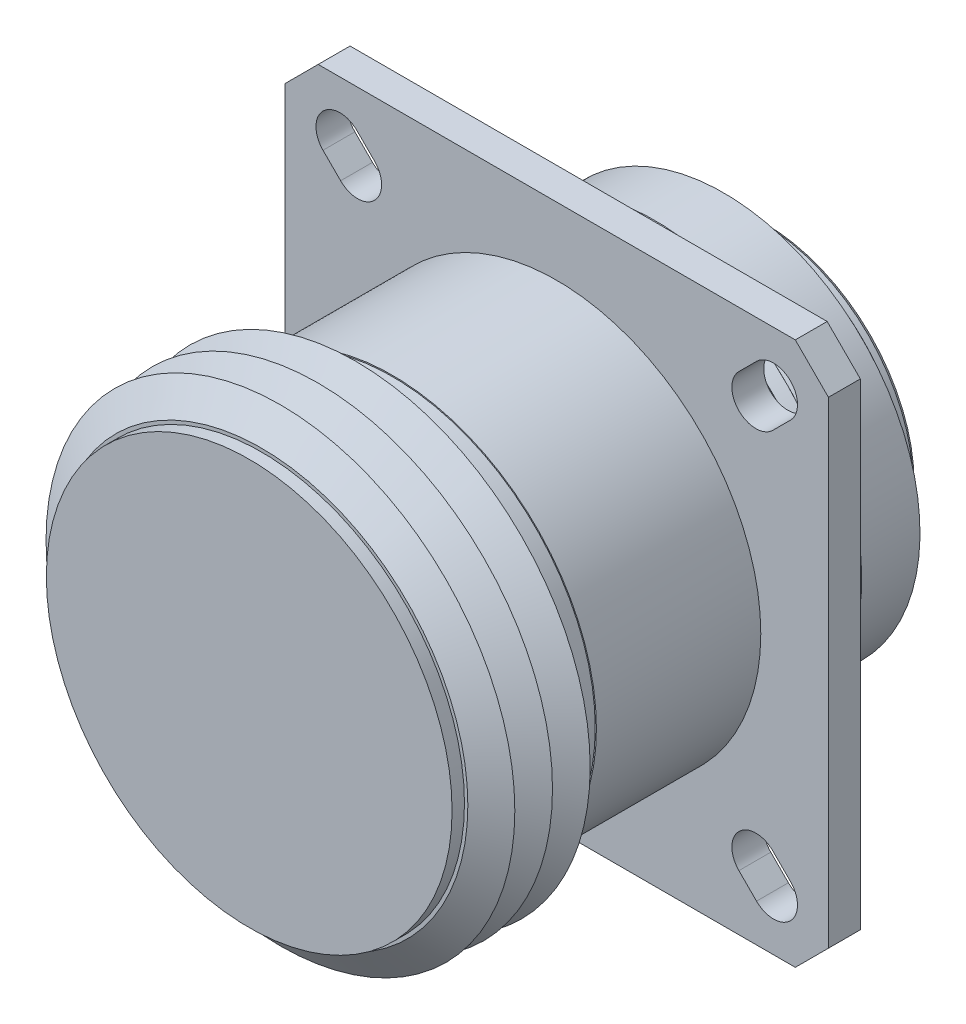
SolidWorks part; units mm, degrees
ref_plane "Front Plane" through (0, 0, 0) normal (0, 0, 1) x (1, 0, 0)
ref_plane "Top Plane" through (0, 0, 0) normal (0, 1, 0) x (1, 0, 0)
ref_plane "Right Plane" through (0, 0, 0) normal (1, 0, 0) x (0, 0, -1)
sketch "Sketch1" plane through (0, 0, 0) normal (0, 0, 1) x (1, 0, 0)
  line L0 (18.4023, 0) -> (0, 0) construction
  line L1 (-18.4023, 18.4023) -> (18.4023, 18.4023)
  line L2 (-18.4023, 18.4023) -> (-18.4023, -18.4023)
  line L3 (-18.4023, -18.4023) -> (18.4023, -18.4023)
  line L4 (18.4023, 18.4023) -> (18.4023, -18.4023)
  line L5 (0, 18.4023) -> (0, 0) construction
  point P0 (-18.4023, 18.4023)
  point P3 (18.4023, 18.4023)
  point P8 (0, -2.2989)
  point P9 (-17.2528, -19.5518)
  point P10 (17.2528, -19.5518)
  point P11 (0, 2.2989)
  point P12 (-19.5518, -17.2528)
  point P13 (19.5518, -17.2528)
  point P14 (18.4023, 0)
  point P30 (0, 18.4023)
  dimension "D1" = 36.8046
  dimension "D11" = 36.8046
extrude "Boss-Extrude1" add sketch "Sketch1" against normal blind 2.159
sketch "Sketch2" plane through (0, 0, 0) normal (0, 0, 1) x (1, 0, 0)
  line L0 (16.1572, 18.4023) -> (18.4023, 16.1572)
  line L1 (18.4023, 18.4023) -> (-18.4023, 18.4023) construction
  line L2 (18.4023, -18.4023) -> (18.4023, 18.4023) construction
  line L3 (18.4023, 16.1572) -> (18.4023, 18.4023)
  line L10 (0, 0) -> (18.4023, -18.4023) construction
  line L11 (14.6369, -12.3379) -> (15.8307, -13.5317)
  line L12 (12.3379, -14.6369) -> (13.5317, -15.8307)
  line L13 (0, 0) -> (-18.4023, -18.4023) construction
  line L14 (-14.6369, -12.3379) -> (-15.8307, -13.5317)
  line L15 (-12.3379, -14.6369) -> (-13.5317, -15.8307)
  line L16 (18.4023, 18.4023) -> (16.1572, 18.4023)
  line L17 (-18.4023, 18.4023) -> (-16.1572, 18.4023)
  line L18 (-16.1572, 18.4023) -> (-18.4023, 16.1572)
  line L19 (-18.4023, 18.4023) -> (-18.4023, -18.4023) construction
  line L20 (-18.4023, 16.1572) -> (-18.4023, 18.4023)
  arc A8 (14.6369, -12.3379) -> (12.3379, -14.6369) centre (13.4874, -13.4874) ccw
  arc A9 (13.5317, -15.8307) -> (15.8307, -13.5317) centre (14.6812, -14.6812) ccw
  arc A10 (-12.3379, -14.6369) -> (-14.6369, -12.3379) centre (-13.4874, -13.4874) ccw
  arc A11 (-15.8307, -13.5317) -> (-13.5317, -15.8307) centre (-14.6812, -14.6812) ccw
  dimension "D1" = 3.2512
  dimension "D2" = 3.2512
  dimension "D3" = 26.9748
  dimension "D4" = 29.3624
  dimension "D5" = 3.175
extrude "Cut-Extrude1" cut sketch "Sketch2" against normal through all
mirror "Mirror2" about plane through (0, 0, 0) normal (0, 1, 0) of "Cut-Extrude1"
sketch "Sketch3" plane through (0, 0, 0) normal (1, 0, 0) x (0, 0, -1)
  line L0 (0, 13.8204) -> (-11.1326, 13.8204)
  line L1 (0, -16.1572) -> (0, 16.1572) construction
  line L2 (-11.1326, 13.8204) -> (-11.1326, 13.7402)
  line L3 (-11.1326, 13.7402) -> (-12.335, 13.7402)
  line L4 (-12.335, 13.9688) -> (-13.6106, 15.875)
  line L5 (-13.6106, 15.875) -> (-14.8862, 13.9688)
  line L6 (-14.8862, 13.9688) -> (-16.1618, 15.875)
  line L7 (-16.1618, 15.875) -> (-17.4375, 13.9688)
  line L8 (-17.4375, 13.9688) -> (-18.7131, 15.875)
  line L9 (-18.7131, 15.875) -> (-19.9887, 13.9688)
  line L10 (-12.335, 13.9688) -> (-12.335, 13.7402)
  line L11 (-19.9887, 13.9688) -> (-19.9887, 13.7402)
  line L12 (-20.828, 13.7402) -> (-20.828, 0)
  line L13 (-20.828, 0) -> (0, 0)
  line L14 (0, 0) -> (7.7116, 0) construction
  line L15 (-20.828, 13.7402) -> (-19.9887, 13.7402)
  line L16 (0, 13.8204) -> (0, 0)
  dimension "D1" = 31.75
  dimension "D2" = 20.828
  dimension "D3" = 27.4803
  dimension "D4" = 27.6407
  dimension "D5" = 27.9375
revolve "Revolve1" add sketch "Sketch3" angle 360 about L14
sketch "Sketch4" plane through (0, 0, 0) normal (1, 0, 0) x (0, 0, -1)
  line L0 (2.159, 0) -> (2.159, 14.8148)
  line L1 (2.159, -16.1572) -> (2.159, 16.1572) construction
  line L2 (2.159, 14.8148) -> (3.5417, 14.8148)
  line L4 (4.1548, 13.296) -> (4.6548, 14)
  line L5 (4.6548, 14) -> (5.1548, 13.296)
  line L6 (5.1548, 13.296) -> (5.6548, 14)
  line L7 (5.6548, 14) -> (6.1548, 13.296)
  line L8 (6.1548, 13.296) -> (6.6548, 14)
  line L9 (6.6548, 14) -> (7.1548, 13.296)
  line L10 (7.1548, 13.296) -> (11.3073, 13.296)
  line L11 (11.3073, 13.296) -> (13.4544, 10.2729)
  line L12 (13.4544, 10.2729) -> (13.8675, 10.2729)
  line L13 (13.8675, 10.2729) -> (14.0716, 10.128)
  line L14 (14.0716, 10.128) -> (14.0716, 0)
  line L15 (14.0716, 0) -> (2.159, 0)
  line L16 (14.0716, 0) -> (17.5354, 0) construction
  line L17 (4.1548, 13.296) -> (3.5417, 13.296)
  line L18 (3.5417, 13.296) -> (3.5417, 14.8148)
  dimension "D1" = 11.9126
  dimension "D2" = 28
  dimension "D3" = 1
  dimension "D4" = 0.704
revolve "M28 x 1.0" add sketch "Sketch4" angle 360 about L16
sketch "Sketch5" [suppressed] plane through (0, 0, -2.159) normal (0, 0, -1) x (-1, 0, 0)
  circle A0 centre (0, 0) radius 14.8148
extrude "Cut-Extrude2" [suppressed] cut sketch "Sketch5" against normal blind 3 flip side to cut
equation "\"Buoyancy\"=\"SW-Volume\"*(\"SW-Density\"-.037062)"
